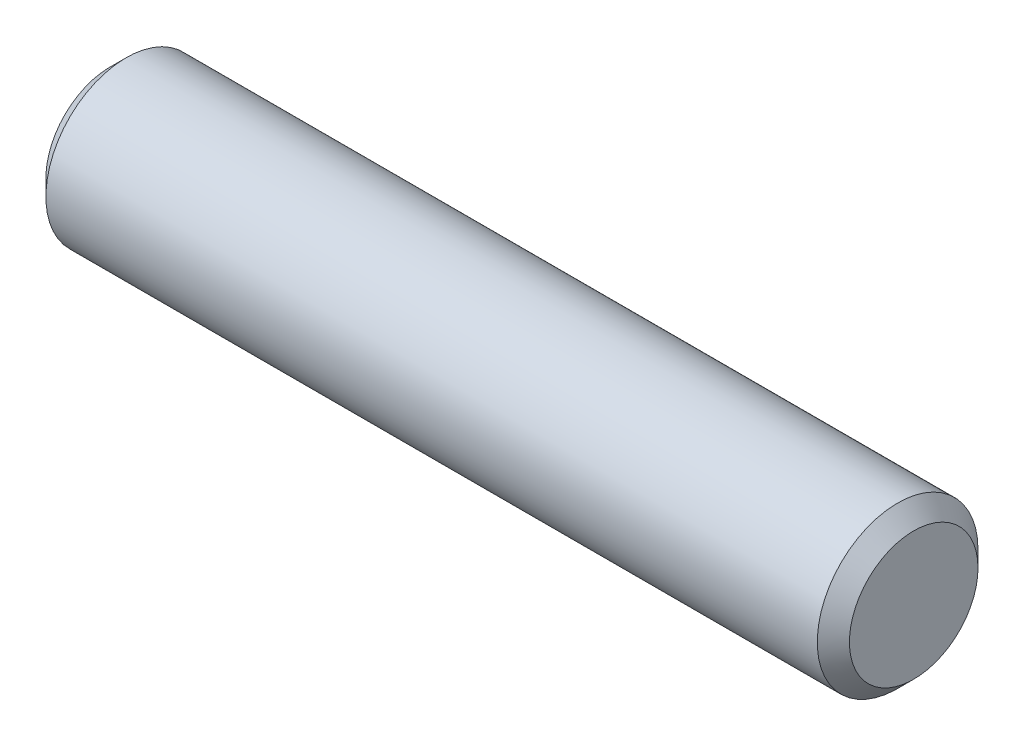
SolidWorks part; units mm, degrees
ref_plane "Face" through (0, 0, 0) normal (0, 0, 1) x (1, 0, 0)
ref_plane "Dessus" through (0, 0, 0) normal (0, 1, 0) x (1, 0, 0)
ref_plane "Droite" through (0, 0, 0) normal (1, 0, 0) x (0, 0, -1)
sketch "Esquisse1" plane through (0, 0, 0) normal (1, 0, 0) x (0, 0, -1)
  circle A0 centre (0, 0) radius 5
extrude "Base-Extrusion" add sketch "Esquisse1" against normal blind 50
chamfer "Chanfrein1" distance 1 angle 45
